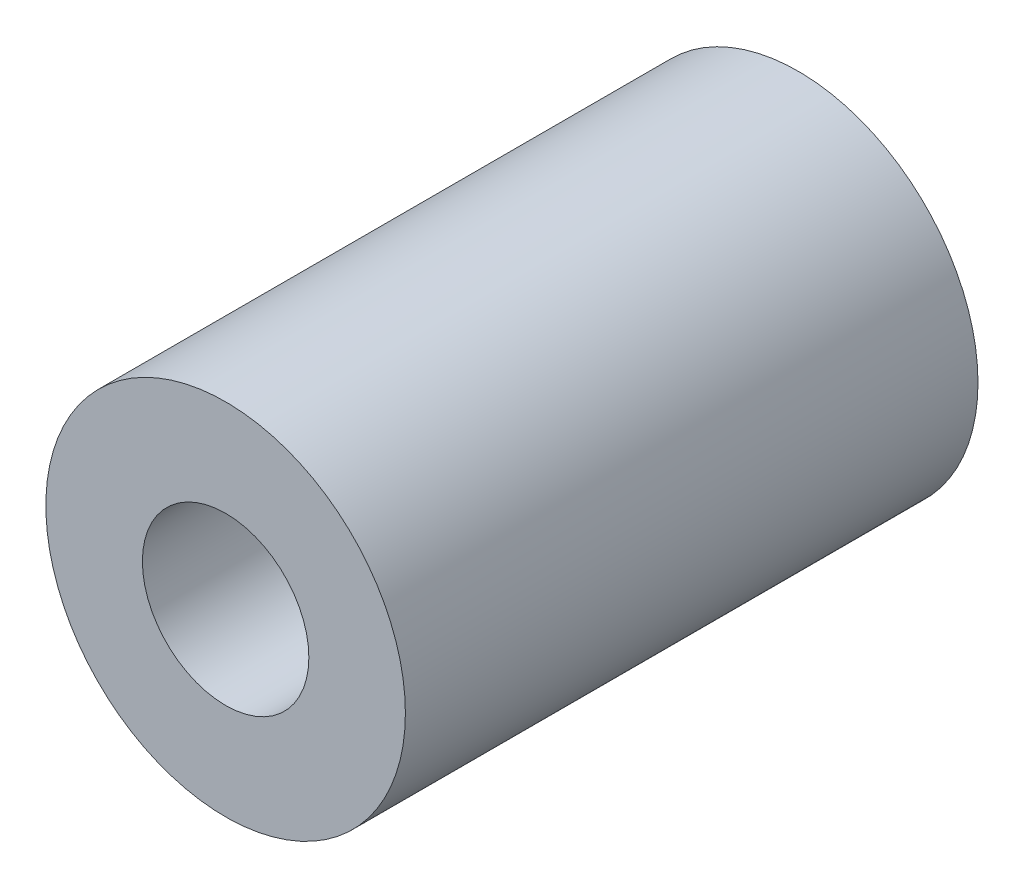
SolidWorks part; units mm, degrees
ref_plane "Front" through (0, 0, 0) normal (0, 0, 1) x (1, 0, 0)
ref_plane "Top" through (0, 0, 0) normal (0, 1, 0) x (1, 0, 0)
ref_plane "Right" through (0, 0, 0) normal (1, 0, 0) x (0, 0, -1)
sketch "Sketch1" plane through (0, 0, 0) normal (0, 0, 1) x (1, 0, 0)
  circle A0 centre (0, 0) radius 13.716
  dimension "D1" = 27.432
extrude "Extrude1" add sketch "Sketch1" along normal blind 43.688
sketch "Sketch2" plane through (0, 0, 43.688) normal (0, 0, 1) x (1, 0, 0)
  circle A0 centre (0, 0) radius 6.35
  dimension "D1" = 12.7
extrude "Cut-Extrude1" cut sketch "Sketch2" against normal blind 19.05
sketch "Sketch3" plane through (0, 0, 0) normal (0, 0, -1) x (-1, 0, 0)
  circle A0 centre (0, 0) radius 4.7625
  dimension "D1" = 9.525
extrude "Cut-Extrude2" cut sketch "Sketch3" against normal blind 19.05
